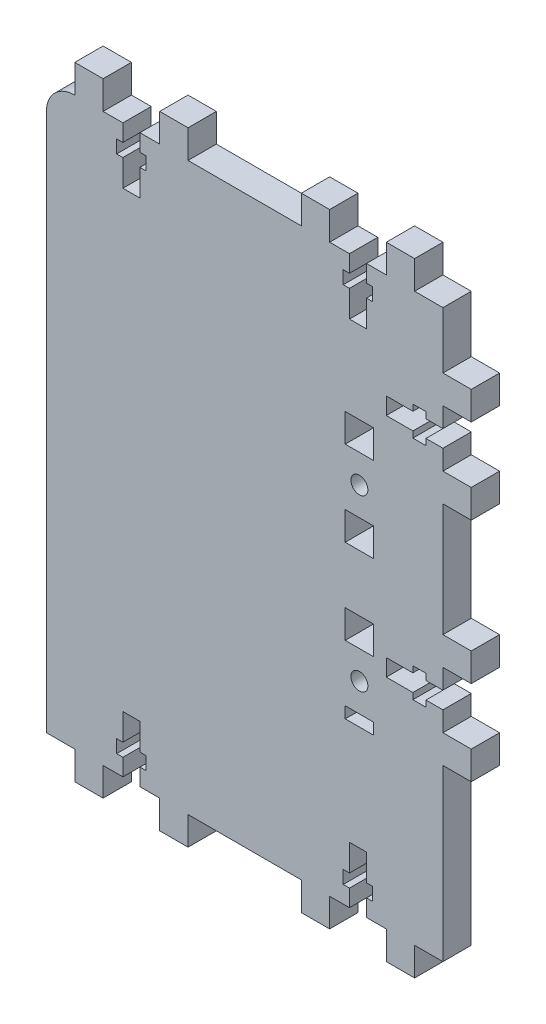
SolidWorks part; units mm, degrees
other "<Batterie_Makita_Adaptateur_Paroi_Laterale>-<Boss-Extrude1>"
ref_plane "Plan de face" through (0, 0, 0) normal (0, 0, 1) x (1, 0, 0)
ref_plane "Plan de dessus" through (0, 0, 0) normal (0, 1, 0) x (1, 0, 0)
ref_plane "Plan de droite" through (0, 0, 0) normal (1, 0, 0) x (0, 0, -1)
inserted part "Batterie_Makita_Adaptateur_Paroi_Laterale"
sketch "Sketch1" plane through (0, 0, 5) normal (0, 0, 1) x (1, 0, 0)
  line L0 (-236.8013, 15.826) -> (-236.8013, -65.674) construction
  line L1 (-236.8013, -55.674) -> (-166.8013, -55.674)
  line L2 (-236.8013, -55.674) -> (-236.8013, -65.674)
  line L3 (-236.8013, -65.674) -> (-166.8013, -65.674)
  line L4 (-166.8013, -55.674) -> (-166.8013, -65.674)
  dimension "D1" = 10
extrude "Cut-Extrude1" cut sketch "Sketch1" against normal through all
sketch "Esquisse1" plane through (0, 0, 5) normal (0, 0, 1) x (1, 0, 0)
  line L0 (-166.8013, -55.674) -> (-166.8013, -84.174)
  line L1 (-166.8013, -84.174) -> (-236.8013, -84.174) construction
  line L2 (-236.8013, -84.174) -> (-236.8013, -55.674)
  line L3 (-191.8013, 15.826) -> (-211.8013, 15.826) construction
  line L4 (-236.8013, -55.674) -> (-166.8013, -55.674)
  line L7 (-236.8013, -84.174) -> (-231.8013, -84.174)
  line L8 (-211.8013, -84.174) -> (-191.8013, -84.174)
  line L9 (-171.8013, -84.174) -> (-166.8013, -84.174)
  line L10 (-181.8013, -84.174) -> (-181.8013, -61.2532) construction
  line L11 (-183.3013, -84.174) -> (-186.8013, -84.174)
  line L12 (-186.8013, -89.174) -> (-191.8013, -89.174)
  line L13 (-191.8013, -89.174) -> (-191.8013, -84.174)
  line L14 (-186.8013, -89.174) -> (-186.8013, -84.174)
  line L15 (-180.3013, -84.174) -> (-176.8013, -84.174)
  line L16 (-176.8013, -84.174) -> (-176.8013, -89.174)
  line L17 (-176.8013, -89.174) -> (-171.8013, -89.174)
  line L18 (-171.8013, -89.174) -> (-171.8013, -84.174)
  line L19 (-183.3013, -84.174) -> (-180.3013, -84.174) construction
  line L20 (-180.3013, -84.174) -> (-180.3013, -81.174)
  line L21 (-180.3013, -78.874) -> (-179.2013, -78.874)
  line L22 (-184.4013, -81.174) -> (-184.4013, -78.874)
  line L23 (-179.2013, -81.174) -> (-180.3013, -81.174)
  line L24 (-180.3013, -78.874) -> (-180.3013, -74.174)
  line L25 (-180.3013, -74.174) -> (-183.3013, -74.174)
  line L26 (-183.3013, -74.174) -> (-183.3013, -78.874)
  line L27 (-183.3013, -81.174) -> (-184.4013, -81.174)
  line L28 (-179.2013, -78.874) -> (-179.2013, -81.174)
  line L29 (-184.4013, -78.874) -> (-183.3013, -78.874)
  line L30 (-183.3013, -81.174) -> (-183.3013, -84.174)
  line L31 (-181.8013, -74.174) -> (-181.8013, -84.174) construction
  line L32 (-221.8013, -84.174) -> (-221.8013, -71.2532) construction
  line L33 (-223.3013, -84.174) -> (-226.8013, -84.174)
  line L34 (-226.8013, -89.174) -> (-231.8013, -89.174)
  line L35 (-231.8013, -89.174) -> (-231.8013, -84.174)
  line L36 (-226.8013, -89.174) -> (-226.8013, -84.174)
  line L37 (-220.3013, -84.174) -> (-216.8013, -84.174)
  line L38 (-216.8013, -84.174) -> (-216.8013, -89.174)
  line L39 (-216.8013, -89.174) -> (-211.8013, -89.174)
  line L40 (-211.8013, -89.174) -> (-211.8013, -84.174)
  line L41 (-223.3013, -84.174) -> (-220.3013, -84.174) construction
  line L42 (-220.3013, -84.174) -> (-220.3013, -81.174)
  line L43 (-220.3013, -78.874) -> (-219.2013, -78.874)
  line L44 (-224.4013, -81.174) -> (-224.4013, -78.874)
  line L45 (-219.2013, -81.174) -> (-220.3013, -81.174)
  line L46 (-220.3013, -78.874) -> (-220.3013, -74.174)
  line L47 (-220.3013, -74.174) -> (-223.3013, -74.174)
  line L48 (-223.3013, -74.174) -> (-223.3013, -78.874)
  line L49 (-223.3013, -81.174) -> (-224.4013, -81.174)
  line L50 (-219.2013, -78.874) -> (-219.2013, -81.174)
  line L51 (-224.4013, -78.874) -> (-223.3013, -78.874)
  line L52 (-223.3013, -81.174) -> (-223.3013, -84.174)
  line L53 (-221.8013, -74.174) -> (-221.8013, -84.174) construction
  line L54 (-220.3013, 10.526) -> (-220.3013, 5.826) construction
  line L55 (-183.3013, 5.826) -> (-183.3013, 10.526) construction
  dimension "D1" = 100
  dimension "D2" = 10
  dimension "D3" = 5
  dimension "D4" = 5
  dimension "D5" = 5.2
  dimension "D6" = 3
  dimension "D7" = 2.3
  dimension "D8" = 3
  dimension "D9" = 10
  dimension "D10" = 10
  dimension "D11" = 5
  dimension "D12" = 5
  dimension "D13" = 5.2
  dimension "D14" = 3
  dimension "D15" = 2.3
  dimension "D16" = 3
  dimension "D17" = 10
extrude "Boss.-Extru.1" add sketch "Esquisse1" against normal up to vertex
fillet "Congé1" radius 5 3 edges at (-236.8013, 15.826, 2.5) (-234.3013, 15.826, 5) (-234.3013, 15.826, 0)
